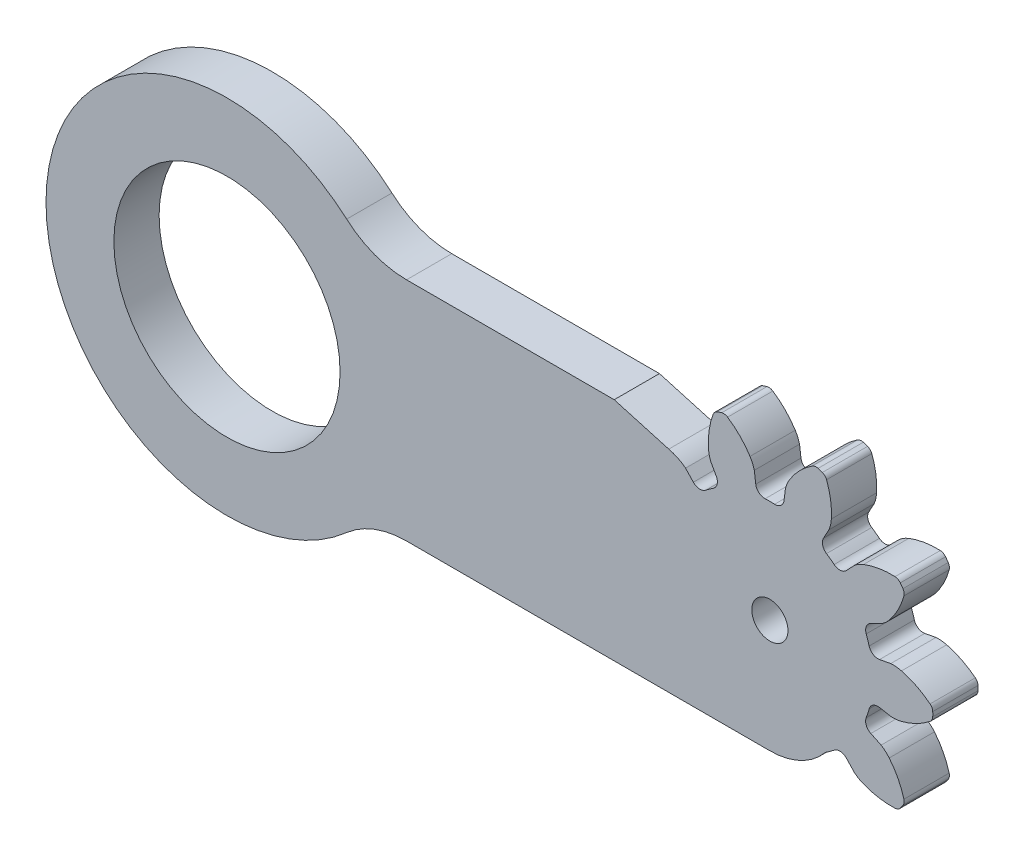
SolidWorks part; units mm, degrees
ref_plane "Plan de face" through (0, 0, 0) normal (0, 0, 1) x (1, 0, 0)
ref_plane "Plan de dessus" through (0, 0, 0) normal (0, 1, 0) x (1, 0, 0)
ref_plane "Plan de droite" through (0, 0, 0) normal (1, 0, 0) x (0, 0, -1)
sketch "Esquisse1" plane through (0, 0, 0) normal (0, 0, 1) x (1, 0, 0)
  line L6 (108.1467, 21.6328) -> (106.9358, 23.845)
  line L7 (116.5534, 26.9699) -> (116.8741, 24.4685)
  line L8 (123.1259, 24.4685) -> (123.4466, 26.9699)
  line L9 (133.0642, 23.845) -> (131.8533, 21.6328)
  line L10 (136.9111, 17.9581) -> (138.6408, 19.7933)
  line L11 (144.5849, 11.612) -> (142.305, 10.5341)
  line L12 (144.2369, 4.5883) -> (146.715, 5.0563)
  line L13 (146.715, -5.0563) -> (144.2369, -4.5883)
  line L14 (142.305, -10.5341) -> (144.5849, -11.612)
  line L15 (138.6408, -19.7933) -> (136.9111, -17.9581)
  line L16 (120, -25) -> (39.5609, -25)
  line L17 (39.5609, 25) -> (85.5905, 25)
  line L18 (85.5905, 25) -> (97.6481, 21.5714)
  line L19 (101.3592, 19.7933) -> (103.0889, 17.9581)
  circle A0 centre (0, 0) radius 22.75
  circle A1 centre (120, 0) radius 4
  arc A2 (103.0889, 17.9581) -> (105.7933, 17.7678) centre (104.5443, 19.3299) ccw
  arc A3 (107.4919, 19.0019) -> (105.7933, 17.7678) centre (120, 0) ccw
  arc A4 (107.4919, 19.0019) -> (108.1467, 21.6328) centre (106.3923, 20.6725) ccw
  arc A5 (106.413, 26.171) -> (106.9358, 23.845) centre (113.7919, 26.6078) ccw
  arc A6 (107.467, 33.1532) -> (106.413, 26.171) centre (123.4039, 27.1767) ccw
  arc A7 (108.4003, 34.08) -> (107.467, 33.1532) centre (108.9438, 32.5994) ccw
  arc A8 (109.3526, 34.3894) -> (108.4003, 34.08) centre (120, 0) ccw
  arc A9 (110.6524, 34.1882) -> (109.3526, 34.3894) centre (109.7832, 32.8721) ccw
  arc A10 (115.6092, 29.159) -> (110.6524, 34.1882) centre (101.2721, 19.9857) ccw
  arc A11 (116.5534, 26.9699) -> (115.6092, 29.159) centre (109.3828, 25.1752) ccw
  arc A12 (116.8741, 24.4685) -> (118.9502, 22.725) centre (118.8579, 24.7228) ccw
  arc A13 (121.0498, 22.725) -> (118.9502, 22.725) centre (120, 0) ccw
  arc A14 (121.0498, 22.725) -> (123.1259, 24.4685) centre (121.1421, 24.7228) ccw
  arc A15 (124.3908, 29.159) -> (123.4466, 26.9699) centre (130.6172, 25.1752) ccw
  arc A16 (129.3476, 34.1882) -> (124.3908, 29.159) centre (138.7279, 19.9857) ccw
  arc A17 (130.6474, 34.3894) -> (129.3476, 34.1882) centre (130.2168, 32.8721) ccw
  arc A18 (131.5997, 34.08) -> (130.6474, 34.3894) centre (120, 0) ccw
  arc A19 (132.533, 33.1532) -> (131.5997, 34.08) centre (131.0562, 32.5994) ccw
  arc A20 (133.587, 26.171) -> (132.533, 33.1532) centre (116.5961, 27.1767) ccw
  arc A21 (133.0642, 23.845) -> (133.587, 26.171) centre (126.2081, 26.6078) ccw
  arc A22 (131.8533, 21.6328) -> (132.5081, 19.0019) centre (133.6077, 20.6725) ccw
  arc A23 (134.2067, 17.7678) -> (132.5081, 19.0019) centre (120, 0) ccw
  arc A24 (134.2067, 17.7678) -> (136.9111, 17.9581) centre (135.4557, 19.3299) ccw
  arc A25 (140.6915, 21.0093) -> (138.6408, 19.7933) centre (143.3871, 14.1265) ccw
  arc A26 (147.6577, 22.1645) -> (140.6915, 21.0093) centre (146.8985, 5.1608) ccw
  arc A27 (148.8275, 21.5633) -> (147.6577, 22.1645) centre (147.5873, 20.5888) ccw
  arc A28 (149.4161, 20.7532) -> (148.8275, 21.5633) centre (120, 0) ccw
  arc A29 (149.6264, 19.4548) -> (149.4161, 20.7532) centre (148.1061, 19.8748) ccw
  arc A30 (146.3751, 13.1866) -> (149.6264, 19.4548) centre (133.2203, 23.9872) ccw
  arc A31 (144.5849, 11.612) -> (146.3751, 13.1866) centre (140.6621, 17.8771) ccw
  arc A32 (142.305, 10.5341) -> (141.2883, 8.0208) centre (143.1599, 8.726) ccw
  arc A33 (141.9371, 6.024) -> (141.2883, 8.0208) centre (120, 0) ccw
  arc A34 (141.9371, 6.024) -> (144.2369, 4.5883) centre (143.8657, 6.5536) ccw
  arc A35 (149.0887, 4.8347) -> (146.715, 5.0563) centre (147.2239, -2.318) ccw
  arc A36 (155.4035, 1.6747) -> (149.0887, 4.8347) centre (144.7947, -11.6354) ccw
  arc A37 (155.9965, 0.5007) -> (155.4035, 1.6747) centre (154.4204, 0.4413) ccw
  arc A38 (155.9965, -0.5007) -> (155.9965, 0.5007) centre (120, 0) ccw
  arc A39 (155.4035, -1.6747) -> (155.9965, -0.5007) centre (154.4204, -0.4413) ccw
  arc A40 (149.0887, -4.8347) -> (155.4035, -1.6747) centre (144.7947, 11.6354) ccw
  arc A41 (146.715, -5.0563) -> (149.0887, -4.8347) centre (147.2239, 2.318) ccw
  arc A42 (144.2369, -4.5883) -> (141.9371, -6.024) centre (143.8657, -6.5536) ccw
  arc A43 (141.2883, -8.0208) -> (141.9371, -6.024) centre (120, 0) ccw
  arc A44 (141.2883, -8.0208) -> (142.305, -10.5341) centre (143.1599, -8.726) ccw
  arc A45 (146.3751, -13.1866) -> (144.5849, -11.612) centre (140.6621, -17.8771) ccw
  arc A46 (149.6264, -19.4548) -> (146.3751, -13.1866) centre (133.2203, -23.9872) ccw
  arc A47 (149.4161, -20.7532) -> (149.6264, -19.4548) centre (148.1061, -19.8748) ccw
  arc A48 (148.8275, -21.5633) -> (149.4161, -20.7532) centre (120, 0) ccw
  arc A49 (147.6577, -22.1645) -> (148.8275, -21.5633) centre (147.5873, -20.5888) ccw
  arc A50 (140.6915, -21.0093) -> (147.6577, -22.1645) centre (146.8985, -5.1608) ccw
  arc A51 (138.6408, -19.7933) -> (140.6915, -21.0093) centre (143.3871, -14.1265) ccw
  arc A52 (136.9111, -17.9581) -> (134.2067, -17.7678) centre (135.4557, -19.3299) ccw
  arc A53 (132.5081, -19.0019) -> (134.2067, -17.7678) centre (120, 0) ccw
  arc A54 (132.5081, -19.0019) -> (132.0784, -19.3836) centre (133.6077, -20.6725) ccw
  arc A55 (120, -25) -> (132.0784, -19.3836) centre (120, -9.204) ccw
  arc A56 (39.5609, -25) -> (22.0431, -30.6458) centre (39.5609, -55) ccw
  arc A57 (22.0431, 30.6458) -> (22.0431, -30.6458) centre (0, 0) ccw
  arc A58 (22.0431, 30.6458) -> (39.5609, 25) centre (39.5609, 55) ccw
  arc A59 (101.3592, 19.7933) -> (97.6481, 21.5714) centre (95.4395, 12.2004) ccw
extrude "Boss.-Extru.1" add sketch "Esquisse1" along normal blind 10
ref_plane "sym" through (0, 0, 5) normal (0, 0, 1) x (1, 0, 0)
sketch "Esquisse3" plane through (0, 0, 10) normal (0, 0, 1) x (1, 0, 0)
  circle A0 centre (0, 0) radius 40
  dimension "D1" = 80
extrude "boss 80" add sketch "Esquisse3" against normal blind 10
sketch "Esquisse2" plane through (0, 0, 10) normal (0, 0, 1) x (1, 0, 0)
  circle A1 centre (0, 0) radius 25
  dimension "D2" = 50
extrude "50" cut sketch "Esquisse2" against normal blind 10
fillet "Congé4" radius 20 4 edges at (39.5609, -25, 5) (34.6464, -25.4053, 0) (34.6464, -25.4053, 10) (29.8647, -26.6101, 5)
fillet "Congé5" radius 20 4 edges at (39.5609, 25, 5) (29.8647, 26.6101, 5) (34.6464, 25.4053, 10) (34.6464, 25.4053, 0)
